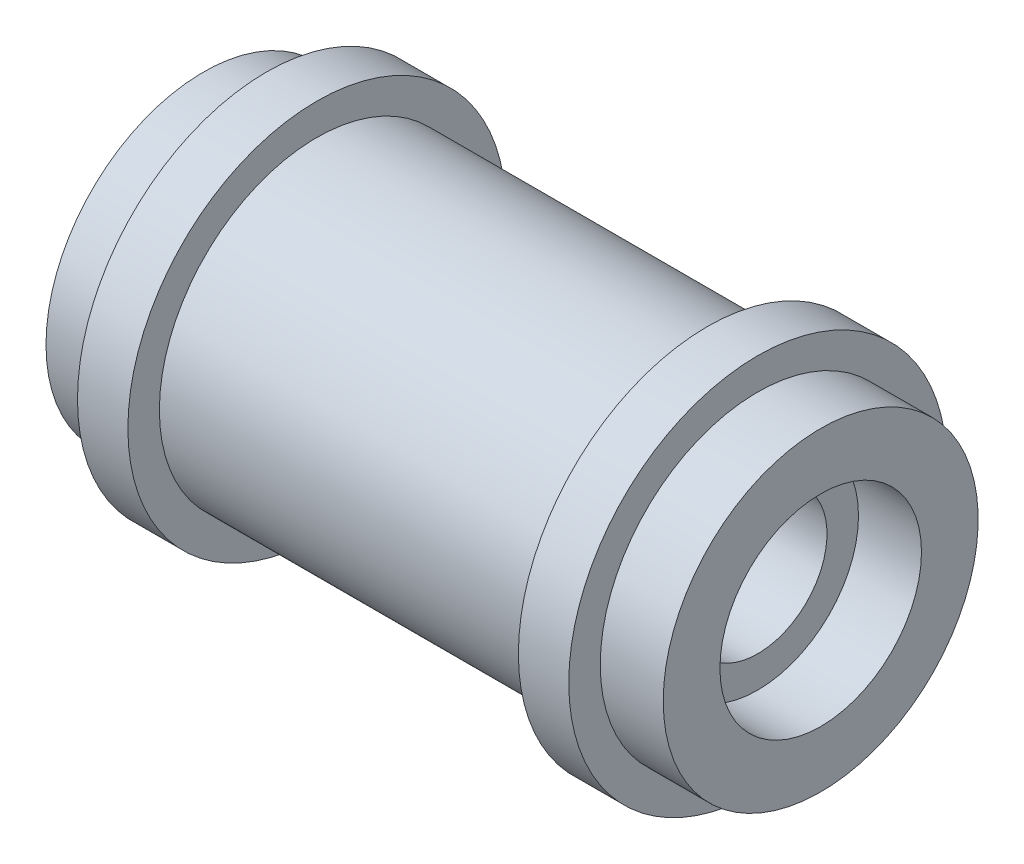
SolidWorks part; units mm, degrees
ref_plane "Plan de face" through (0, 0, 0) normal (0, 0, 1) x (1, 0, 0)
ref_plane "Plan de dessus" through (0, 0, 0) normal (0, 1, 0) x (1, 0, 0)
ref_plane "Plan de droite" through (0, 0, 0) normal (1, 0, 0) x (0, 0, -1)
sketch "Esquisse1" plane through (0, 0, 0) normal (0, 0, 1) x (1, 0, 0)
  line L0 (-49, 0) -> (49, 0) construction
  line L1 (-49, 16) -> (-39, 16)
  line L2 (-39, 16) -> (-39, 11)
  line L3 (-39, 11) -> (39, 11)
  line L4 (0, 25) -> (0, 0) construction
  line L5 (31, 25) -> (-31, 25)
  line L6 (-31, 25) -> (-31, 30)
  line L7 (-31, 30) -> (-39, 30)
  line L8 (-39, 30) -> (-39, 25)
  line L9 (-39, 25) -> (-49, 25)
  line L10 (-49, 25) -> (-49, 16)
  line L11 (49, 25) -> (49, 16)
  line L12 (39, 25) -> (49, 25)
  line L13 (39, 30) -> (39, 25)
  line L14 (31, 30) -> (39, 30)
  line L15 (31, 25) -> (31, 30)
  line L16 (39, 16) -> (39, 11)
  line L17 (49, 16) -> (39, 16)
  point P21 (0, 11)
  dimension "D1" = 98
  dimension "D2" = 60
  dimension "D3" = 32
  dimension "D4" = 22
  dimension "D5" = 10
  dimension "D6" = 8
  dimension "D7" = 50
revolve "Révolution1" add sketch "Esquisse1" angle 360 about L0
